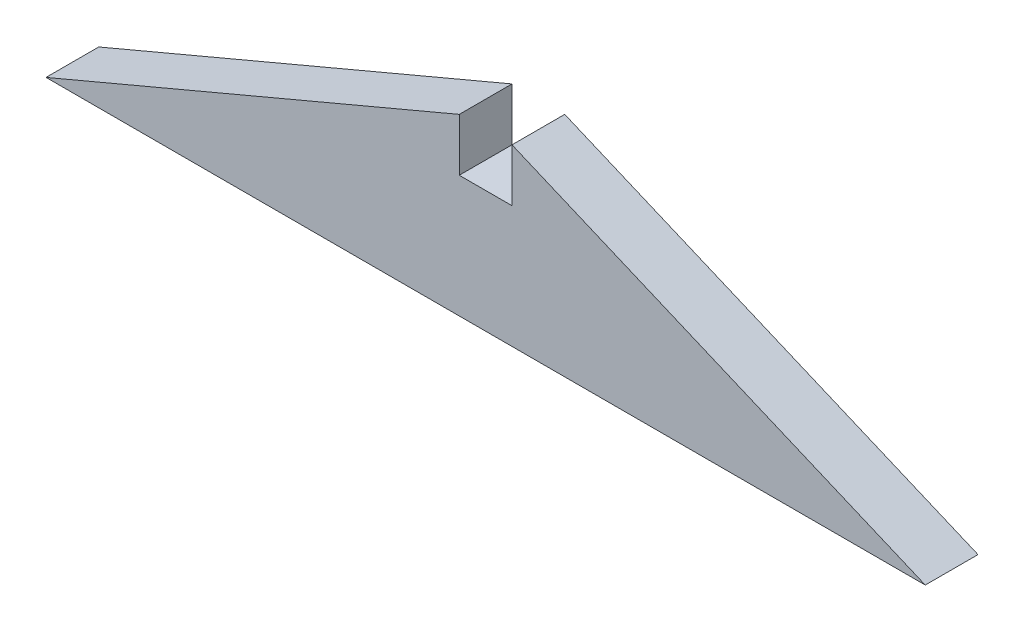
SolidWorks part; units mm, degrees
ref_plane "Front Plane" through (0, 0, 0) normal (0, 0, 1) x (1, 0, 0)
ref_plane "Top Plane" through (0, 0, 0) normal (0, 1, 0) x (1, 0, 0)
ref_plane "Right Plane" through (0, 0, 0) normal (1, 0, 0) x (0, 0, -1)
sketch "Sketch1" plane through (0, 0, 0) normal (0, 0, 1) x (1, 0, 0)
  line L0 (0, -50.8) -> (0, -2032) construction
  line L1 (-473.0229, 50.8) -> (473.0229, 50.8) construction
  line L3 (-713.4762, -50.8) -> (713.4762, -50.8) construction
  line L5 (-812.8, 50.8) -> (812.8, -50.8) construction
  line L6 (-812.8, -50.8) -> (812.8, 50.8) construction
  line L7 (-1219.2, -2032) -> (1219.2, -2032) construction
  line L8 (-914.4, -50.8) -> (914.4, -50.8) construction
  line L9 (-1219.2, -2032) -> (-914.4, -50.8) construction
  line L10 (-1116.4047, -2032) -> (-811.6047, -50.8) construction
  line L11 (-1118.7814, -2047.449) -> (-813.9814, -66.249) construction
  line L12 (0, -50.8) -> (0, 355.6) construction
  line L13 (-12.7, -50.8) -> (-12.7, 355.6) construction
  line L14 (-914.4, -25.4) -> (-12.7, 355.6) construction
  line L15 (-914.4, -50.8) -> (-812.8, -50.8) construction
  line L16 (-914.4, -50.8) -> (-914.4, -25.4) construction
  line L17 (-914.4, -25.4) -> (-812.8, -25.4) construction
  line L19 (-818.427, -95.1454) -> (-12.7, 245.3026) construction
  line L20 (-914.4, -25.4) -> (-812.8, -25.4) construction
  line L21 (-812.8, -25.4) -> (-812.8, -50.8) construction
  line L22 (-874.8556, -118.9885) -> (26.8444, 262.0115) construction
  line L23 (-812.8, -50.8) -> (-811.6047, -50.8) construction
  line L24 (-811.6047, -50.8) -> (-818.427, -95.1454) construction
  line L25 (-12.7, 355.6) -> (-12.7, 245.3026) construction
  line L26 (-713.4762, -50.8) -> (-473.0229, 50.8) construction
  line L27 (713.4762, -50.8) -> (473.0229, 50.8) construction
  line L28 (12.7, -50.8) -> (12.7, 355.6) construction
  line L29 (914.4, -25.4) -> (12.7, 355.6) construction
  line L30 (818.427, -95.1454) -> (12.7, 245.3026) construction
  point P0 (0, 0)
  point P11 (0, -2032)
  point P13 (0, -50.8)
  dimension "D1" = 101.6
  dimension "D2" = 1625.6
  dimension "D3" = 1981.2
  dimension "D4" = 2438.4
  dimension "D5" = 1828.8
  dimension "D7" = 406.4
  dimension "D9" = 25.4
  dimension "D10" = 101.6
  dimension "D6" = 101.6
  dimension "D8" = 12.7
  dimension "D11" = 101.6
sketch "Sketch2" plane through (0, 0, 0) normal (0, 0, 1) x (1, 0, 0)
  line L0 (-12.7, 245.3026) -> (-12.7, 234.9095)
  line L1 (-12.7, 234.9095) -> (12.7, 234.9095)
  line L2 (12.7, 234.9095) -> (12.7, 245.3026)
  line L5 (-211.757, 176.2009) -> (211.757, 176.2009)
  line L12 (-12.7, 245.3026) -> (-12.7, 260.3095)
  line L15 (-211.757, 176.2009) -> (-12.7, 260.3095)
  line L16 (211.757, 176.2009) -> (12.7, 260.3095)
  line L20 (12.7, 245.3026) -> (12.7, 260.3095)
  point P6 (-818.427, -95.1454)
  point P8 (818.427, -95.1454)
  dimension "D1" = 25.4
extrude "Boss-Extrude1" add sketch "Sketch2" along normal blind 25.4
